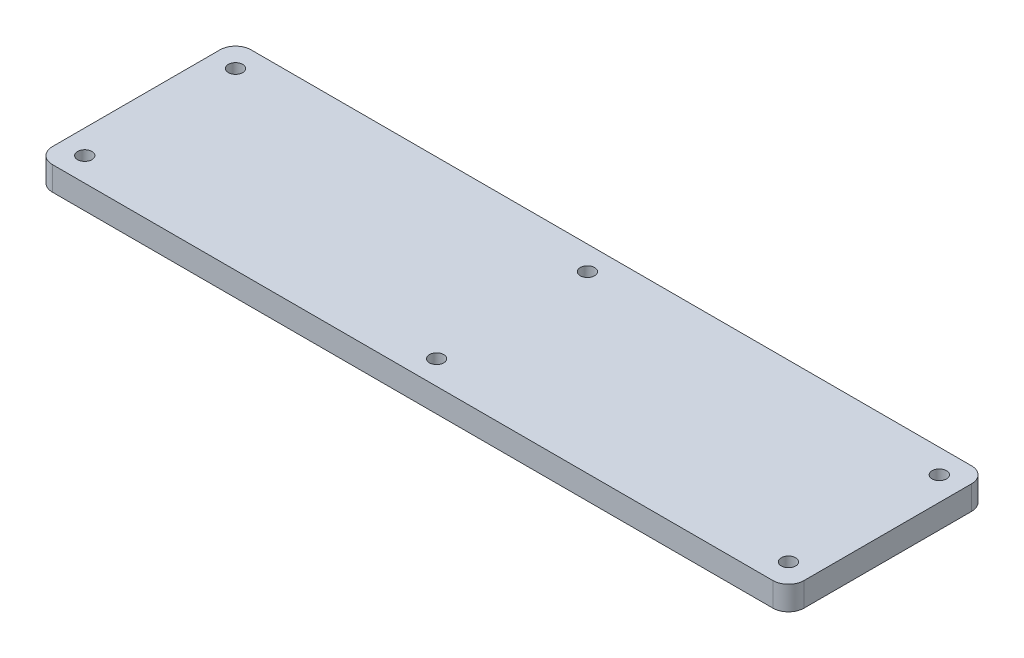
SolidWorks part; units mm, degrees
ref_plane "Front Plane" through (0, 0, 0) normal (0, 0, 1) x (1, 0, 0)
ref_plane "Top Plane" through (0, 0, 0) normal (0, 1, 0) x (1, 0, 0)
ref_plane "Right Plane" through (0, 0, 0) normal (1, 0, 0) x (0, 0, -1)
sketch "Sketch1" plane through (0, 0, 0) normal (0, 1, 0) x (1, 0, 0)
  line L1 (-39.878, 21.082) -> (39.878, 21.082)
  line L2 (-39.878, 21.082) -> (-39.878, -21.082)
  line L3 (-39.878, -21.082) -> (39.878, -21.082)
  line L4 (39.878, 21.082) -> (39.878, -21.082)
  line L5 (-39.878, 21.082) -> (39.878, -21.082) construction
  line L6 (-39.878, -21.082) -> (39.878, 21.082) construction
  point P0 (0, 0)
  dimension "D1" = 42.164
  dimension "D2" = 79.756
extrude "Plate" add sketch "Sketch1" along normal blind 5.08
fillet "Fillet1" radius 3.302 2 edges at (-39.878, 2.54, -21.082) (-39.878, 2.54, 21.082)
sketch "Sketch2" plane through (0, 5.08, 0) normal (0, 1, 0) x (1, 0, 0)
  line L1 (39.878, -21.082) -> (39.878, 21.082) construction
  line L2 (39.878, 21.082) -> (-36.576, 21.082) construction
  line L3 (-36.576, -21.082) -> (39.878, -21.082) construction
  line L4 (-39.878, 17.78) -> (-39.878, -17.78) construction
  circle A0 centre (-34.798, 16.002) radius 1.524
  circle A1 centre (39.878, 16.002) radius 1.524
  circle A2 centre (-34.798, -16.002) radius 1.524
  circle A3 centre (39.878, -16.002) radius 1.524
  dimension "D6" = 3.048
  dimension "D1" = 74.676
  dimension "D2" = 5.08
  dimension "D3" = 5.08
  dimension "D4" = 32.004
  dimension "D5" = 5.08
extrude "4-40ThruHoles" cut sketch "Sketch2" against normal through all
mirror "Mirror1" about plane through (0, 5.08, 0) normal (0, 1, 0) of "4-40ThruHoles", "Fillet1", "Plate"
